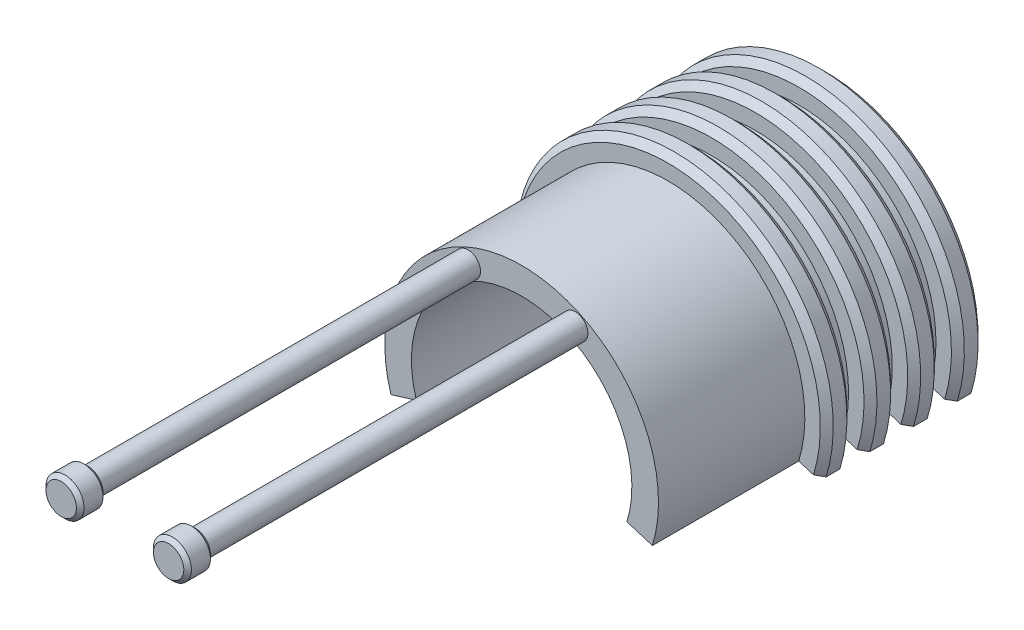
SolidWorks part; units mm, degrees
ref_plane "Front Plane" through (0, 0, 0) normal (0, 0, 1) x (1, 0, 0)
ref_plane "Top Plane" through (0, 0, 0) normal (0, 1, 0) x (1, 0, 0)
ref_plane "Right Plane" through (0, 0, 0) normal (1, 0, 0) x (0, 0, -1)
sketch "Sketch1" plane through (0, 0, 0) normal (0, 0, 1) x (1, 0, 0)
  line L2 (-27.702, -8.5789) -> (-34.3887, -10.6496)
  line L4 (34.3887, -10.6496) -> (27.702, -8.5789)
  arc A0 (27.702, -8.5789) -> (-27.702, -8.5789) centre (0, 0) ccw
  arc A1 (34.3887, -10.6496) -> (-34.3887, -10.6496) centre (0, 0) ccw
extrude "Boss-Extrude1" add sketch "Sketch1" along normal blind 80
sketch "Sketch2" plane through (0, 0, 80) normal (0, 0, 1) x (1, 0, 0)
  circle A0 centre (25.3769, 20.194) radius 1.8767
extrude "Boss-Extrude2" add sketch "Sketch2" along normal blind 100
sketch "Sketch3" plane through (0, 0, 80) normal (0, 0, 1) x (1, 0, 0)
  line L0 (0, 36) -> (0, 0)
  arc A0 (34.3887, -10.6496) -> (-34.3887, -10.6496) centre (0, 0) ccw construction
  circle A1 centre (0, 0) radius 32.4312
  circle A2 centre (14.1275, 29.1924) radius 3.3
  circle A3 centre (-14.1275, 29.1924) radius 3.3
extrude "Boss-Extrude3" add sketch "Sketch3" along normal blind 100 contours A1 A3 | A1 A2 | A1 A2
sketch "Sketch4" plane through (0, 0, 180) normal (0, 0, 1) x (1, 0, 0)
  circle A0 centre (25.3769, 20.194) radius 1.8767
extrude "Cut-Extrude1" cut sketch "Sketch4" against normal blind 100
sketch "Sketch5" plane through (0, 0, 0) normal (0, 0, -1) x (-1, 0, 0)
  line L0 (-34.3887, -10.6496) -> (-39.8966, -12.3553)
  line L1 (34.3887, -10.6496) -> (39.8966, -12.3553)
  arc A0 (39.8966, -12.3553) -> (-39.8966, -12.3553) centre (0, 0) ccw
  arc A1 (34.3887, -10.6496) -> (-34.3887, -10.6496) centre (0, 0) ccw
extrude "Boss-Extrude4" add sketch "Sketch5" against normal blind 7
chamfer "Chamfer1" distance 1.7 angle 45 2 edges at (0, 41.766, 7) (0, 41.766, 0)
pattern_linear "LPattern1" count 4 spacing 11.5 along (0, 0, 1) of "Boss-Extrude4", "Chamfer1"
sketch "Sketch6" plane through (0, 0, 180) normal (0, 0, 1) x (1, 0, 0)
  circle A0 centre (-14.1275, 29.1924) radius 5
  circle A1 centre (14.1275, 29.1924) radius 5
extrude "Boss-Extrude5" add sketch "Sketch6" along normal blind 7
chamfer "Chamfer2" distance 1 angle 45 3 edges at (-9.1275, 29.1924, 187) (19.1275, 29.1924, 187) (19.1275, 29.1924, 180)
chamfer "Chamfer3" distance 1 angle 45 1 edges at (-9.1275, 29.1924, 180)
